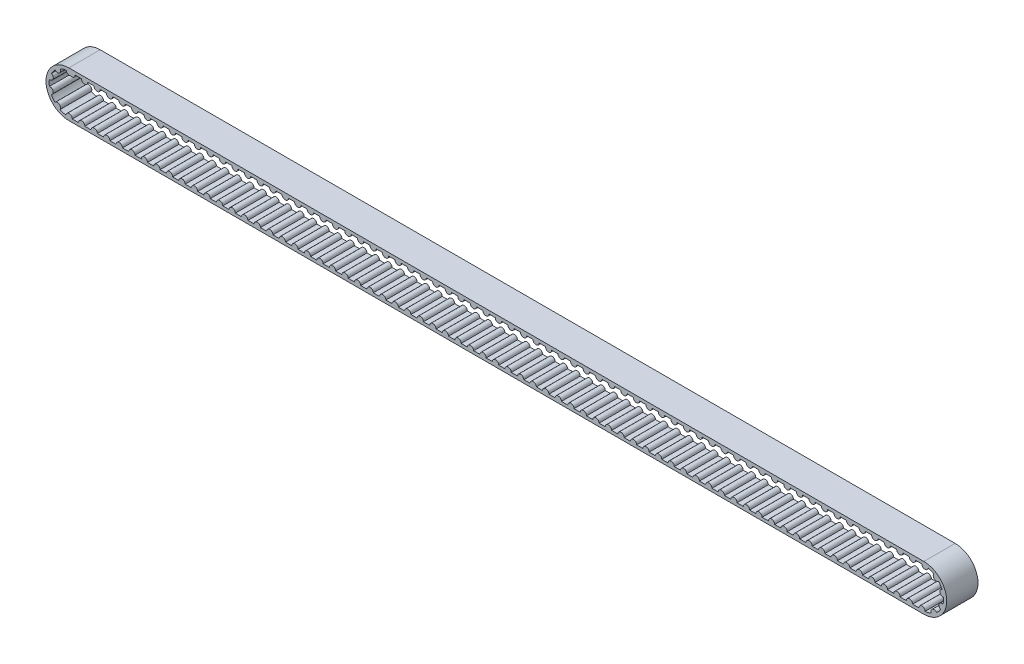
SolidWorks part; units mm, degrees
ref_plane "Plan de face" through (0, 0, 0) normal (0, 0, 1) x (1, 0, 0)
ref_plane "Plan de dessus" through (0, 0, 0) normal (0, 1, 0) x (1, 0, 0)
ref_plane "Plan de droite" through (0, 0, 0) normal (1, 0, 0) x (0, 0, -1)
sketch "Esquisse1" plane through (0, 0, 0) normal (0, 0, 1) x (1, 0, 0)
  line L0 (0, 0) -> (546, 0) construction
  line L1 (0, 12.6) -> (546, 12.6)
  line L2 (0, -12.6) -> (546, -12.6)
  line L3 (0, 14.6) -> (546, 14.6)
  line L4 (0, -14.6) -> (546, -14.6)
  arc A0 (0, 12.6) -> (0, -12.6) centre (0, 0) ccw
  arc A1 (546, -12.6) -> (546, 12.6) centre (546, 0) ccw
  arc A2 (546, -14.6) -> (546, 14.6) centre (546, 0) ccw
  arc A3 (0, 14.6) -> (0, -14.6) centre (0, 0) ccw
  point P3 (273, 0)
  dimension "D2" = 12.6
  dimension "D1" = 546
  dimension "D3" = 2
extrude "Boss.-Extru.1" add sketch "Esquisse1" along normal mid plane 20
sketch "Esquisse3" plane through (0, 0, 0) normal (0, 0, 1) x (1, 0, 0)
  line L4 (546, 12.6) -> (0, 12.6)
  line L5 (0, -12.6) -> (546, -12.6)
  line L6 (546, 12.6) -> (0, 12.6)
  line L7 (0, -12.6) -> (546, -12.6)
  arc A4 (546, -12.6) -> (546, 12.6) centre (546, 0) ccw
  arc A5 (0, 12.6) -> (0, -12.6) centre (0, 0) ccw
  arc A6 (546, -12.6) -> (546, 12.6) centre (546, 0) ccw
  arc A7 (0, 12.6) -> (0, -12.6) centre (0, 0) ccw
  dimension "D1" = 0
sketch "Esquisse2" plane through (0, 0, 0) normal (0, 0, 1) x (1, 0, 0)
  line L0 (546, 12.6) -> (0, 12.6) construction
  line L1 (0, 12.6) -> (4, 12.6)
  arc A1 (0, 12.6) -> (4, 12.6) centre (2, 12.6) ccw
  dimension "D1" = 2
extrude "Boss.-Extru.2" add sketch "Esquisse2" along normal mid plane 20
pattern_curve "Répét. par courbe1" of "Boss.-Extru.2" parameters "D1"=321, "D3"=8.01, "D2"=1, "D4"=50
